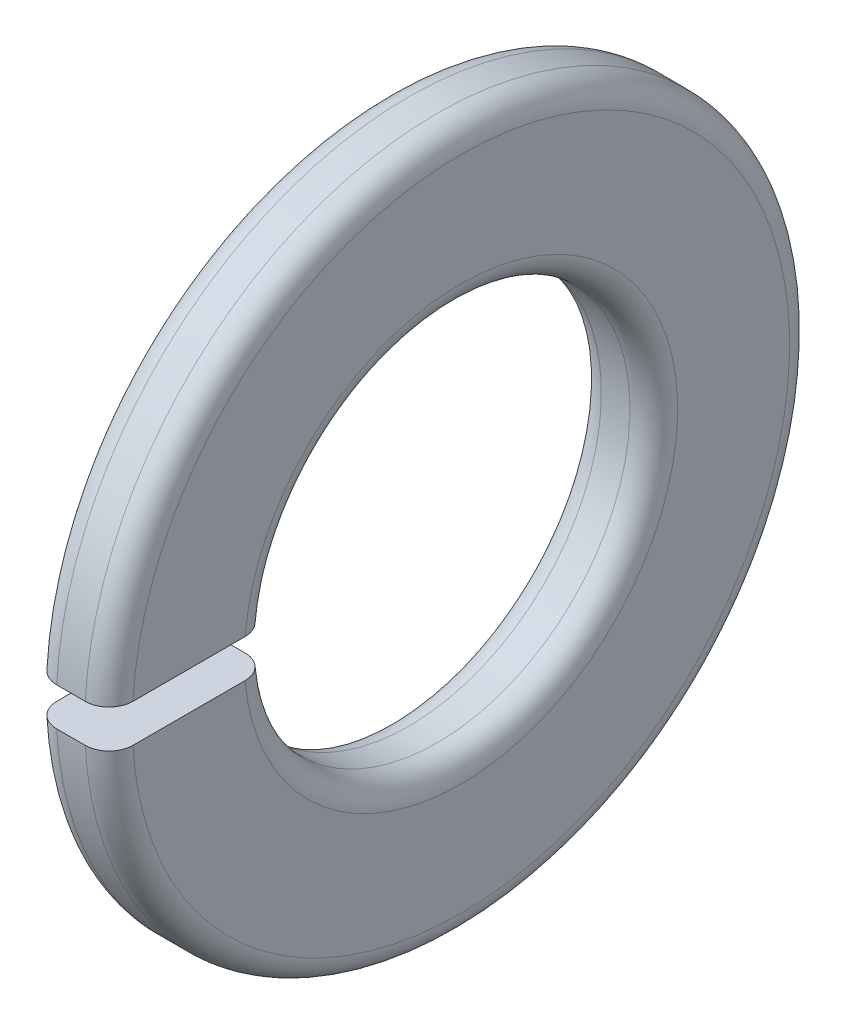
SolidWorks part; units mm, degrees
ref_plane "Plane1" through (0, 0, 0) normal (0, 0, 1) x (1, 0, 0)
ref_plane "Plane2" through (0, 0, 0) normal (0, 1, 0) x (1, 0, 0)
ref_plane "Plane3" through (0, 0, 0) normal (1, 0, 0) x (0, 0, -1)
sketch "Sketch1" plane through (0, 0, 0) normal (0, 0, 1) x (1, 0, 0)
  line L0 (-34.925, 0) -> (9.525, 0) construction
  line L1 (0, 4.55) -> (0, 7.4)
  line L2 (0, 7.4) -> (-1.6, 7.4)
  line L3 (-1.6, 7.4) -> (-1.6, 4.55)
  line L4 (-1.1, 4.05) -> (-0.5, 4.05)
  arc A0 (-1.1, 4.05) -> (-1.6, 4.55) centre (-1.1, 4.55) cw
  arc A1 (0, 4.55) -> (-0.5, 4.05) centre (-0.5, 4.55) cw
  point P8 (-1.6, 4.05)
  dimension "Fillet_rad" = 0.5
  dimension "D1" = 0.5
  dimension "Thickness" = 1.6
  dimension "Inside_dia" = 8.1
  dimension "Outside_dia" = 14.8
revolve "Base-Revolve" add sketch "Sketch1" angle 360 about L0
sketch "Sketch2" plane through (0, 0, 0) normal (-1, 0, 0) x (0, -1, 0)
  line L0 (-0.4, 0) -> (0.4, 0)
  line L1 (0, 0) -> (0, 12.7) construction
  line L2 (0.4, 0) -> (0.4, 7.548)
  line L3 (0.4, 7.548) -> (-0.4, 7.548)
  line L4 (-0.4, 7.548) -> (-0.4, 0)
  dimension "D1" = 0.8
  dimension "D2" = 7.548
extrude "Gap" cut sketch "Sketch2" along normal through all
fillet "Congé1" radius 0.5 2 edges at (0, 0, -7.4) (-1.6, 0, -7.4)
equation "\"D1@Sketch1\" = \"Fillet_rad@Sketch1\""
equation "\"D1@Sketch2\" = \"Thickness@Sketch1\" * 0.5"
equation "\"D2@Sketch2\" = \"Outside_dia@Sketch1\" * 0.51"
